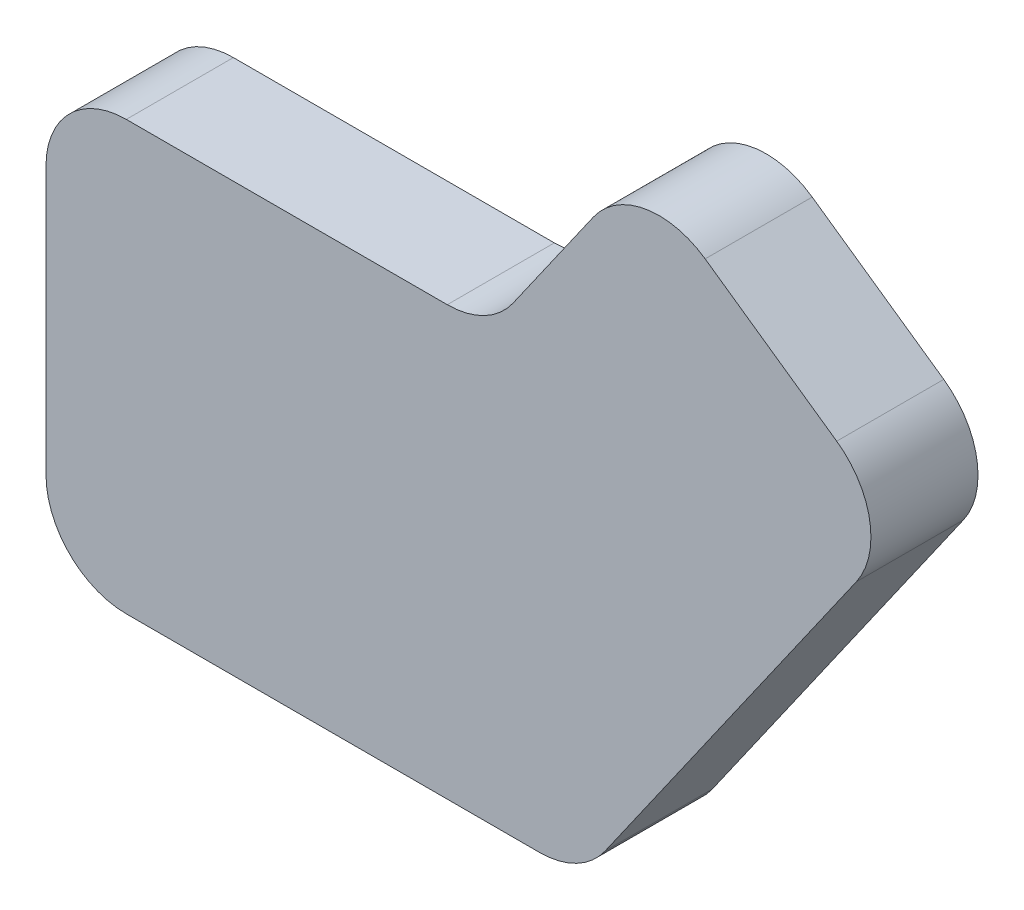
SolidWorks part; units mm, degrees
ref_plane "Front Plane" through (0, 0, 0) normal (0, 0, 1) x (1, 0, 0)
ref_plane "Top Plane" through (0, 0, 0) normal (0, 1, 0) x (1, 0, 0)
ref_plane "Right Plane" through (0, 0, 0) normal (1, 0, 0) x (0, 0, -1)
sketch "Sketch1" plane through (0, 0, 0) normal (0, 0, 1) x (1, 0, 0)
  line L0 (4.7625, 0) -> (29.2708, 0)
  line L1 (33.172, 2.0308) -> (48.0683, 23.305)
  line L2 (46.8988, 29.9379) -> (39.0964, 35.4012)
  line L3 (32.4635, 34.2316) -> (27.7015, 27.4308)
  line L4 (23.8003, 25.4) -> (4.7625, 25.4)
  line L5 (0, 20.6375) -> (0, 4.7625)
  arc A0 (4.7625, 25.4) -> (0, 20.6375) centre (4.7625, 20.6375) ccw
  arc A1 (27.7015, 27.4308) -> (23.8003, 25.4) centre (23.8003, 30.1625) cw
  arc A2 (39.0964, 35.4012) -> (32.4635, 34.2316) centre (36.3647, 31.5) ccw
  arc A3 (48.0683, 23.305) -> (46.8988, 29.9379) centre (44.1671, 26.0367) ccw
  arc A4 (29.2708, 0) -> (33.172, 2.0308) centre (29.2708, 4.7625) ccw
  arc A5 (4.7625, 0) -> (0, 4.7625) centre (4.7625, 4.7625) cw
  point P9 (0, 25.4)
  point P14 (35.1952, 38.1329)
  point P17 (50.8, 27.2062)
  point P20 (31.75, 0)
  point P23 (0, 0)
  dimension "D6" = 4.7625
  dimension "D1" = 31.75
  dimension "D2" = 50.8
  dimension "D3" = 19.05
  dimension "D4" = 25.4
  dimension "D5" = 125
extrude "Extrude1" add sketch "Sketch1" along normal blind 6.35
